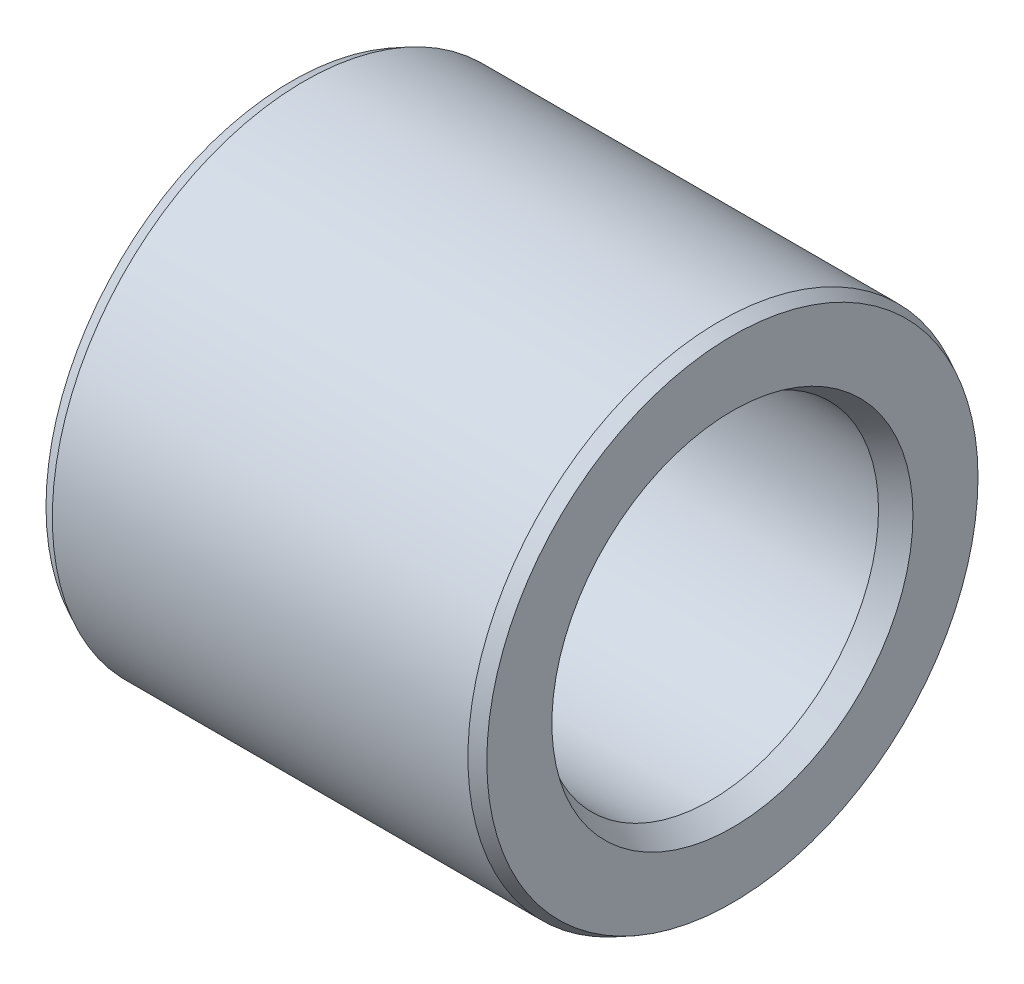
SolidWorks part; units mm, degrees
ref_plane "Front Plane" through (0, 0, 0) normal (0, 0, 1) x (1, 0, 0)
ref_plane "Top Plane" through (0, 0, 0) normal (0, 1, 0) x (1, 0, 0)
ref_plane "Right Plane" through (0, 0, 0) normal (1, 0, 0) x (0, 0, -1)
sketch "Esquisse1" plane through (0, 0, 0) normal (0, 0, 1) x (1, 0, 0)
  line L0 (0, 5.85) -> (0, 4.3)
  line L1 (0, 4.3) -> (0.5196, 4)
  line L2 (0.5196, 4) -> (9.9804, 4)
  line L3 (9.9804, 4) -> (10.5, 4.3)
  line L4 (10.5, 4.3) -> (10.5, 5.85)
  line L5 (10.5, 5.85) -> (10.2, 6)
  line L6 (10.2, 6) -> (0.3, 6)
  line L7 (0.3, 6) -> (0, 5.85)
  line L8 (0, 0) -> (10.5, 0) construction
revolve "Révolution1" add sketch "Esquisse1" angle 360 about L8
